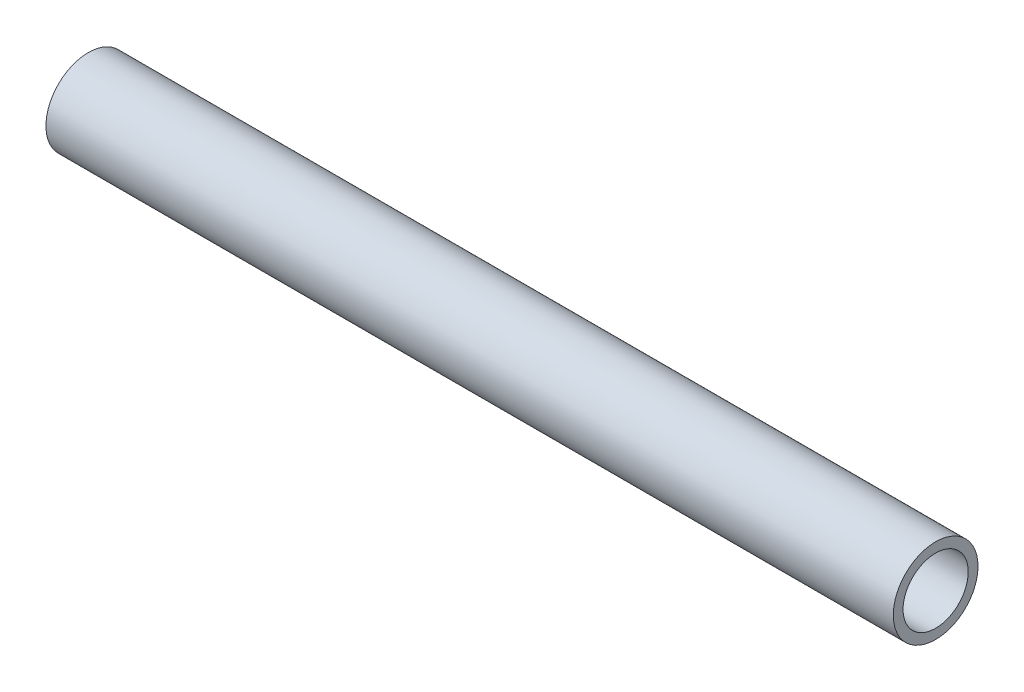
SolidWorks part; units mm, degrees
ref_plane "Front" through (0, 0, 0) normal (0, 0, 1) x (1, 0, 0)
ref_plane "Top" through (0, 0, 0) normal (0, 1, 0) x (1, 0, 0)
ref_plane "Right" through (0, 0, 0) normal (1, 0, 0) x (0, 0, -1)
sketch "Sketch1" plane through (0, 0, 0) normal (0, 0, 1) x (1, 0, 0)
  line L0 (0, 0) -> (330.2, 0)
  line L1 (9.9848, 0) -> (-9.9848, 0) construction
  dimension "D1" = 330.2
other "Structural Member1"
ref_plane "Plane1" through (0, 0, 0) normal (1, 0, 0) x (0, 0, -1)
sketch "Sketch11" plane through (0, 0, 0) normal (1, 0, 0) x (0, 0, -1)
  circle A0 centre (0, 0) radius 12.7
  circle A1 centre (0, 0) radius 16.51
  point P3 (0, 0)
  dimension "D1" = 33.02
  dimension "D2" = 25.4
